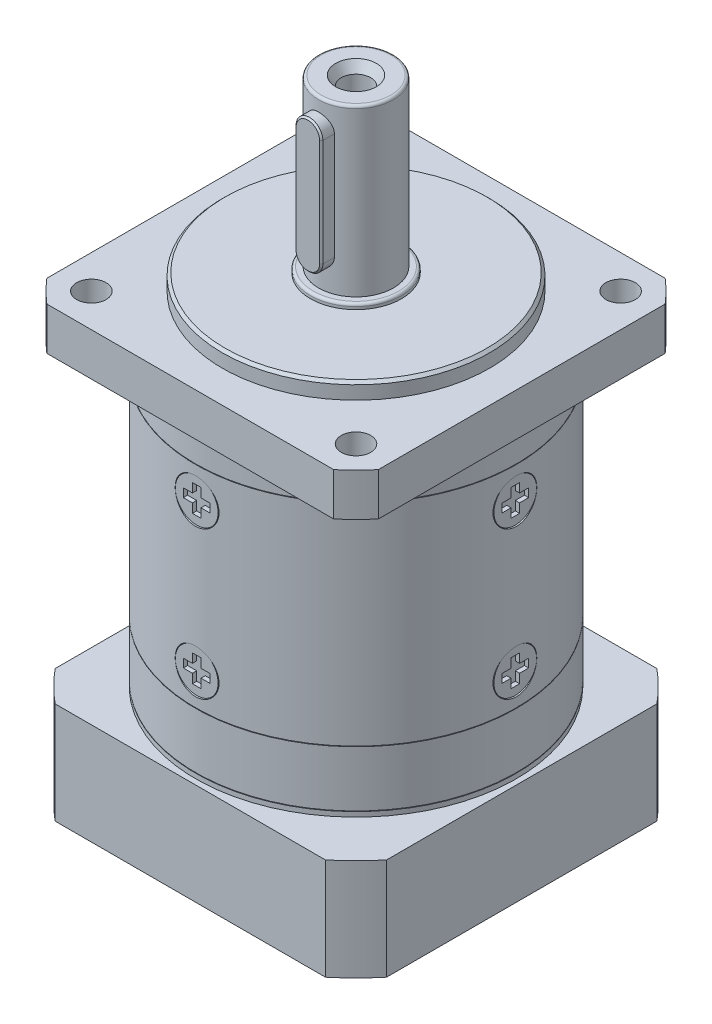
SolidWorks part; units mm, degrees
ref_plane "前视基准面" through (0, 0, 0) normal (0, 0, 1) x (1, 0, 0)
ref_plane "上视基准面" through (0, 0, 0) normal (0, 1, 0) x (1, 0, 0)
ref_plane "右视基准面" through (0, 0, 0) normal (1, 0, 0) x (0, 0, -1)
sketch "草图1" plane through (0, 0, 0) normal (0, 1, 0) x (1, 0, 0)
  circle A0 centre (0, 0) radius 25
extrude "凸台-拉伸1" add sketch "草图1" along normal blind 3
sketch "草图2" plane through (0, 0, 0) normal (0, -1, 0) x (1, 0, 0)
  circle A0 centre (0, 0) radius 30
extrude "凸台-拉伸2" add sketch "草图2" along normal blind 13
sketch "草图23" plane through (0, 0, 0) normal (0, 1, 0) x (1, 0, 0)
  line L1 (-31, 31) -> (31, 31)
  line L2 (-31, 31) -> (-31, -31)
  line L3 (-31, -31) -> (31, -31)
  line L4 (31, 31) -> (31, -31)
  dimension "D1" = 31
  dimension "D2" = 62
  dimension "D3" = 31
  dimension "D4" = 62
extrude "凸台-拉伸13" add sketch "草图23" against normal blind 8
sketch "草图24" plane through (0, 0, 0) normal (0, 1, 0) x (1, 0, 0)
  circle A0 centre (0, 0) radius 41
extrude "切除-拉伸7" cut sketch "草图24" against normal blind 8 flip side to cut
sketch "草图25" plane through (0, 0, 0) normal (0, 1, 0) x (1, 0, 0)
  line L0 (0, 0) -> (-28.9914, 28.9914) construction
  circle A0 centre (0, 0) radius 35 construction
  arc A1 (-26.8328, 31) -> (-31, 26.8328) centre (0, 0) ccw construction
  circle A2 centre (-24.7487, 24.7487) radius 2.75
extrude "切除-拉伸8" cut sketch "草图25" against normal blind 8
pattern_circular "阵列(圆周)23" count 4 over 360 about axis through (0, 0, 0) along (0, 1, 0) of "切除-拉伸8"
chamfer "倒角5" distance 0.5 angle 45 1 edges at (0, 3, 25)
ref_plane "基准面1" through (0, -13.1, 0) normal (0, -1, 0) x (1, 0, 0)
sketch "草图3" plane through (0, -13.1, 0) normal (0, -1, 0) x (1, 0, 0)
  circle A0 centre (0, 0) radius 30
extrude "凸台-拉伸3" add sketch "草图3" along normal blind 39.4 separate body
ref_plane "基准面2" through (0, -52.6, 0) normal (0, -1, 0) x (1, 0, 0)
sketch "草图4" plane through (0, -52.6, 0) normal (0, -1, 0) x (1, 0, 0)
  circle A0 centre (0, 0) radius 30
extrude "凸台-拉伸4" add sketch "草图4" along normal blind 10.4 separate body
ref_plane "基准面3" through (0, -63.1, 0) normal (0, -1, 0) x (1, 0, 0)
sketch "草图5" plane through (0, -63.1, 0) normal (0, -1, 0) x (1, 0, 0)
  circle A0 centre (0, 0) radius 30
extrude "凸台-拉伸5" add sketch "草图5" along normal blind 0.9 separate body
sketch "草图6" plane through (0, -64, 0) normal (0, -1, 0) x (1, 0, 0)
  line L1 (-25.2784, 31) -> (25.2784, 31)
  line L2 (-31, 25.2784) -> (-31, -25.2784)
  line L3 (-25.2784, -31) -> (25.2784, -31)
  line L4 (31, 25.2784) -> (31, -25.2784)
  arc A0 (-25.2784, 31) -> (-31, 25.2784) centre (0, 0) ccw
  arc A1 (-31, -25.2784) -> (-25.2784, -31) centre (0, 0) ccw
  arc A2 (25.2784, -31) -> (31, -25.2784) centre (0, 0) ccw
  arc A3 (31, 25.2784) -> (25.2784, 31) centre (0, 0) ccw
  dimension "D1" = 31
  dimension "D3" = 31
extrude "凸台-拉伸6" add sketch "草图6" along normal blind 19
sketch "草图7" plane through (0, -83, 0) normal (0, -1, 0) x (1, 0, 0)
  circle A0 centre (0, 0) radius 25
extrude "切除-拉伸1" cut sketch "草图7" against normal blind 5
sketch "草图8" plane through (0, -78, 0) normal (0, -1, 0) x (1, 0, 0)
  circle A0 centre (0, 0) radius 17.5
extrude "切除-拉伸2" cut sketch "草图8" against normal blind 19
ref_plane "基准面4" through (0, -76, 0) normal (0, -1, 0) x (1, 0, 0)
sketch "草图9" plane through (0, -76, 0) normal (0, -1, 0) x (1, 0, 0)
  circle A0 centre (0, 0) radius 16
extrude "凸台-拉伸7" add sketch "草图9" against normal up to surface (17 mm away)
chamfer "倒角1" distance 1 angle 45 1 edges at (0, -76, -16)
sketch "草图10" plane through (0, -83, 0) normal (0, -1, 0) x (1, 0, 0)
  circle A0 centre (0, 0) radius 7
extrude "切除-拉伸3" cut sketch "草图10" against normal blind 32
sketch "草图11" plane through (0, -76, 0) normal (0, -1, 0) x (1, 0, 0)
  line L1 (-16.7216, 0.5) -> (16.9728, 0.5)
  line L2 (-16.7216, 0.5) -> (-16.7216, -0.5)
  line L3 (-16.7216, -0.5) -> (16.9728, -0.5)
  line L4 (16.9728, 0.5) -> (16.9728, -0.5)
  dimension "D1" = 0.5
  dimension "D2" = 1
extrude "切除-拉伸4" cut sketch "草图11" against normal up to surface (17 mm away)
sketch "草图12" plane through (0, -83, 0) normal (0, -1, 0) x (1, 0, 0)
  line L0 (0, 0) -> (0, 25.5) construction
  line L1 (0, 0) -> (-12.75, 22.0836) construction
  circle A0 centre (0, 0) radius 25.5 construction
  circle A1 centre (-12.75, 22.0836) radius 4
  dimension "D1" = 30
extrude "切除-拉伸5" cut sketch "草图12" against normal blind 12
pattern_circular "阵列(圆周)1" count 4 over 360 about axis through (0, 0, 0) along (0, 1, 0) of "切除-拉伸5"
sketch "草图13" plane through (0, -83, 0) normal (0, -1, 0) x (1, 0, 0)
  line L0 (0, 0) -> (-24.7487, -24.7487)
  circle A0 centre (0, 0) radius 35
hole_wizard "M4 螺纹孔1" positions "3D草图1" profile "草图14" tap size "M4" standard "GB"
sketch3d "3D草图1"
  point P0 (-24.7487, -83, -24.7487)
sketch "草图14" plane through (-24.7487, -83, -24.7487) normal (1, 0, 0) x (0, 0, -1)
  line L0 (0, 0) -> (0, 14.4914)
  line L1 (0, 14.4914) -> (1.65, 13.5)
  line L2 (1.65, 13.5) -> (1.65, 0)
  line L5 (1.65, 0) -> (0, 0)
  line L10 (0, 14.4914) -> (-1.65, 13.5) construction
  line L11 (0, -6.35) -> (0, 107.95) construction
  dimension "螺纹孔钻头直径" = 3.3
  dimension "螺纹孔钻头深度" = 13.5
  dimension "导头角度" = 118
pattern_circular "阵列(圆周)2" count 4 over 360 about axis through (0, 0, 0) along (0, 1, 0) of "M4 螺纹孔1"
sketch "草图15" plane through (0, 3, 0) normal (0, 1, 0) x (1, 0, 0)
  circle A0 centre (0, 0) radius 8.5
extrude "凸台-拉伸8" add sketch "草图15" along normal blind 1
sketch "草图16" plane through (0, 4, 0) normal (0, 1, 0) x (1, 0, 0)
  circle A0 centre (0, 0) radius 7
extrude "凸台-拉伸9" add sketch "草图16" along normal blind 31
fillet "圆角1" radius 0.5 1 edges at (0, 4, 8.5)
fillet "圆角2" radius 0.5 1 edges at (0, 35, 7)
ref_plane "基准面5" through (0, 0, 30) normal (0, 0, 1) x (1, 0, 0)
ref_plane "基准面6" through (0, 0, 29) normal (0, 0, 1) x (1, 0, 0)
sketch "草图19" plane through (0, 0, 29) normal (0, 0, 1) x (1, 0, 0)
  line L0 (-30, -13) -> (30, -13) construction
  line L1 (30, -52.6) -> (-30, -52.6) construction
  circle A0 centre (0, -19) radius 4.1
  circle A1 centre (0, -46.6) radius 4.1
  dimension "D1" = 6
  dimension "D2" = 6
extrude "切除-拉伸6" cut sketch "草图19" along normal blind 31
pattern_circular "阵列(圆周)5" count 4 over 360 about axis through (0, 0, 0) along (0, 1, 0) of "切除-拉伸6"
sketch "草图20" plane through (0, 0, 29) normal (0, 0, 1) x (1, 0, 0)
  line L0 (0.8, -19.8) -> (0.8, -21.5)
  line L1 (-0.8, -16.5) -> (0.8, -16.5)
  line L2 (-0.8, -16.5) -> (-0.8, -18.2)
  line L3 (-0.8, -21.5) -> (0.8, -21.5)
  line L4 (0.8, -16.5) -> (0.8, -18.2)
  line L5 (-2.5, -18.2) -> (-0.8, -18.2)
  line L6 (-2.5, -18.2) -> (-2.5, -19.8)
  line L7 (-2.5, -19.8) -> (-0.8, -19.8)
  line L8 (2.5, -18.2) -> (2.5, -19.8)
  line L9 (-0.8, -19.8) -> (-0.8, -21.5)
  line L10 (0.8, -18.2) -> (2.5, -18.2)
  line L11 (0.8, -19.8) -> (2.5, -19.8)
  line L12 (0.8, -47.4) -> (0.8, -49.1)
  line L13 (-2.5, -45.8) -> (-0.8, -45.8)
  line L14 (-2.5, -45.8) -> (-2.5, -47.4)
  line L15 (-2.5, -47.4) -> (-0.8, -47.4)
  line L16 (2.5, -45.8) -> (2.5, -47.4)
  line L17 (-0.8, -44.1) -> (0.8, -44.1)
  line L18 (-0.8, -44.1) -> (-0.8, -45.8)
  line L19 (-0.8, -49.1) -> (0.8, -49.1)
  line L20 (0.8, -44.1) -> (0.8, -45.8)
  line L21 (-0.8, -47.4) -> (-0.8, -49.1)
  line L22 (0.8, -45.8) -> (2.5, -45.8)
  line L23 (0.8, -47.4) -> (2.5, -47.4)
  circle A0 centre (0, -19) radius 4
  circle A1 centre (0, -46.6) radius 4
  dimension "D1" = 0.8
  dimension "D9" = 0.8
  dimension "D2" = 1.6
  dimension "D3" = 0.8
  dimension "D4" = 1.6
  dimension "D5" = 2.5
  dimension "D6" = 5
  dimension "D7" = 2.5
  dimension "D8" = 5
  dimension "D10" = 1.6
  dimension "D11" = 0.8
  dimension "D12" = 1.6
  dimension "D13" = 2.5
  dimension "D14" = 5
  dimension "D15" = 2.5
  dimension "D16" = 5
extrude "凸台-拉伸10" add sketch "草图20" along normal blind 0.8
pattern_circular "阵列(圆周)21" count 4 over 360 about axis through (0, 0, 0) along (0, 1, 0) of "凸台-拉伸10"
sketch "草图21" plane through (0, -71, 0) normal (0, -1, 0) x (1, 0, 0)
  line L1 (-11.8663, 23.5733) -> (-13.5983, 23.5938)
  line L2 (-13.5983, 23.5938) -> (-14.4819, 22.1041)
  line L3 (-14.4819, 22.1041) -> (-13.6337, 20.594)
  line L4 (-13.6337, 20.594) -> (-11.9017, 20.5735)
  line L5 (-11.9017, 20.5735) -> (-11.0181, 22.0632)
  line L6 (-11.0181, 22.0632) -> (-11.8663, 23.5733)
  circle A0 centre (-12.75, 22.0836) radius 3.5
  circle A1 centre (-12.75, 22.0836) radius 1.5 construction
  dimension "D1" = 3
extrude "凸台-拉伸11" add sketch "草图21" along normal blind 4
pattern_circular "阵列(圆周)22" count 4 over 360 about axis through (0, 0, 0) along (0, 1, 0) of "凸台-拉伸11"
sketch "草图22" plane through (0, 0, 0) normal (0, 0, 1) x (1, 0, 0)
  line L0 (6.5, 35) -> (-6.5, 35) construction
  line L1 (-2.5, 30) -> (-2.5, 10)
  line L2 (2.5, 30) -> (2.5, 10)
  arc A0 (2.5, 30) -> (-2.5, 30) centre (0, 30) ccw
  arc A1 (-2.5, 10) -> (2.5, 10) centre (0, 10) ccw
  dimension "D1" = 5
  dimension "D2" = 20
extrude "凸台-拉伸12" add sketch "草图22" along normal blind 9
chamfer "倒角4" distance 0.3 angle 45 4 edges at (-2.5, 20, 9) (0, 7.5, 9) (0, 32.5, 9) (2.5, 20, 9)
sketch "草图26" plane through (0, 35, 0) normal (0, 1, 0) x (1, 0, 0)
  circle A0 centre (0, 0) radius 3.8
sketch "草图27" plane through (0, 35, 0) normal (0, 1, 0) x (1, 0, 0)
  circle A0 centre (0, 0) radius 2.75
extrude "切除-拉伸9" cut sketch "草图27" against normal blind 4.8
ref_plane "基准面7" through (0, 33.2, 0) normal (0, 1, 0) x (-1, 0, 0)
sketch "草图28" plane through (0, 33.2, 0) normal (0, 1, 0) x (-1, 0, 0)
  circle A0 centre (0, 0) radius 2.75 construction
  circle A1 centre (0, 0) radius 2.75
loft "切除-放样1" cut profiles "草图26", "草图28"
hole_wizard "M5 螺纹孔1" positions "3D草图2" profile "草图29" tap size "M5" standard "GB"
sketch3d "3D草图2"
  line L0 (0, 30.2, 0) -> (0, 33.2, 0) construction
  point P0 (0, 30.2, 0)
sketch "草图29" plane through (0, 30.2, 0) normal (1, 0, 0) x (0, 0, 1)
  line L0 (0, 0) -> (0, 11.2618)
  line L1 (0, 11.2618) -> (2.1, 10)
  line L2 (2.1, 10) -> (2.1, 0)
  line L5 (2.1, 0) -> (0, 0)
  line L10 (0, 11.2618) -> (-2.1, 10) construction
  line L11 (0, -6.35) -> (0, 107.95) construction
  dimension "螺纹孔钻头直径" = 4.2
  dimension "螺纹孔钻头深度" = 10
  dimension "导头角度" = 118
